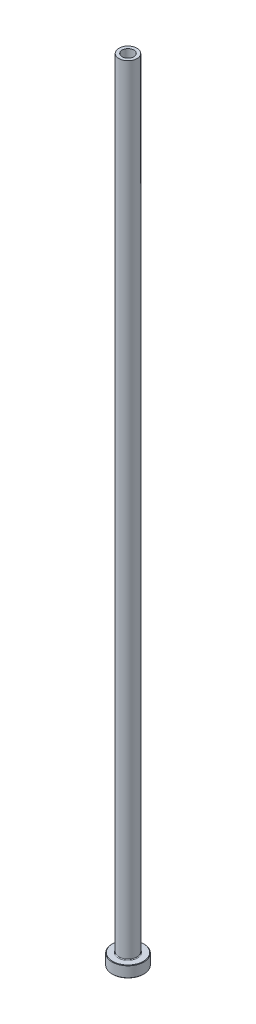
SolidWorks part; units mm, degrees
ref_plane "Front Plane" through (0, 0, 0) normal (0, 0, 1) x (1, 0, 0)
ref_plane "Top Plane" through (0, 0, 0) normal (0, 1, 0) x (1, 0, 0)
ref_plane "Right Plane" through (0, 0, 0) normal (1, 0, 0) x (0, 0, -1)
sketch "Sketch1" plane through (0, 0, 0) normal (0, 0, 1) x (1, 0, 0)
  line L0 (-2.6, 350) -> (-4, 350)
  line L1 (-4, 350) -> (-4, 5)
  line L2 (-4, 5) -> (-7, 5)
  line L3 (-7, 5) -> (-7, 0)
  line L4 (7.7, 0) -> (-7.7, 0) construction
  line L5 (-7, 0) -> (-2.85, 0)
  line L6 (-2.6, 305) -> (-2.6, 350)
  line L7 (0, 92.1877) -> (0, -15.5353) construction
  line L8 (0, -7.7) -> (0, 7.7) construction
  line L9 (-2.6, 305) -> (-2.85, 293)
  line L10 (-2.85, 293) -> (-2.85, 0)
  dimension "D1" = 0.25
  dimension "ID" = 5.2
  dimension "OD" = 8
  dimension "L" = 350
  dimension "H" = 14
  dimension "T" = 5
  dimension "N" = 45
  dimension "D2" = 12
revolve "Revolve1" add sketch "Sketch1" angle 360 about L7
fillet "Fillet1" radius 0.3 1 edges at (0, 5, 4)
chamfer "Chamfer1" distance 0.2 angle 45 2 edges at (0, 5, 7) (0, 0, 7)
chamfer "Chamfer3" distance 0.5 angle 45 1 edges at (0, 0, 2.85)
